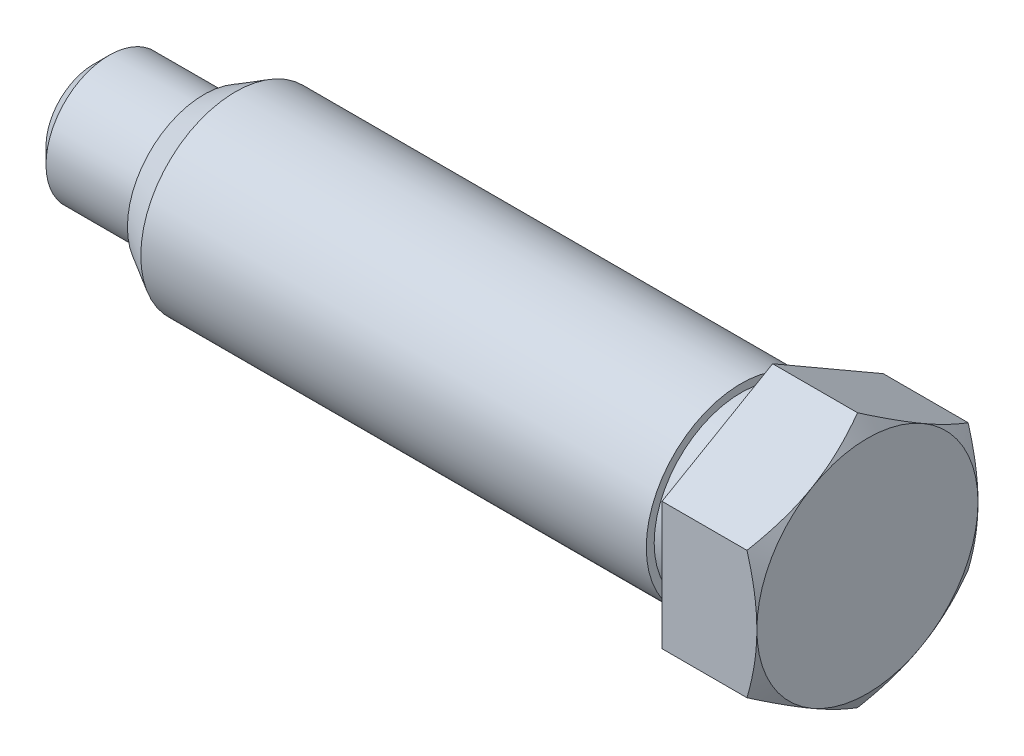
SolidWorks part; units mm, degrees
ref_plane "Plan1" through (0, 0, 0) normal (0, 0, 1) x (1, 0, 0)
ref_plane "Plan2" through (0, 0, 0) normal (0, 1, 0) x (1, 0, 0)
ref_plane "Plan3" through (0, 0, 0) normal (1, 0, 0) x (0, 0, -1)
sketch "Esquisse1" plane through (0, 0, 0) normal (0, 0, 1) x (1, 0, 0)
  line L0 (-100, 0) -> (100, 0) construction
  line L1 (-80, 0) -> (-80, 4)
  line L2 (-80, 4) -> (-73, 4)
  line L3 (-73, 4) -> (-73, 4.8453)
  line L4 (-73, 4.8453) -> (-71, 6)
  line L5 (-71, 6) -> (-39, 6)
  line L6 (-39, 6) -> (-39, 5.5)
  line L7 (-39, 5.5) -> (-37, 5.5)
  line L8 (-37, 5.5) -> (-37, 9)
  line L9 (-37, 9) -> (-32.1547, 9)
  line L10 (-31, 7) -> (-31, 0)
  line L11 (-80, 0) -> (-31, 0)
  line L12 (-31, 7) -> (-32.1547, 9)
  dimension "D1" = 7
  dimension "D2" = 4
  dimension "D3" = 6
  dimension "D4" = 150
  dimension "D5" = 2
  dimension "D6" = 2
  dimension "D7" = 36
  dimension "D8" = 5.5
  dimension "D9" = 7
  dimension "D10" = 9
  dimension "D11" = 30
revolve "Base-Révolution" add sketch "Esquisse1" angle 360 about L0
chamfer "Chanfrein1" distance 1 angle 45
sketch "Esquisse2" plane through (-31, 0, 0) normal (1, 0, 0) x (0, 0, -1)
  line L1 (-7, 10) -> (7, 10)
  line L2 (-7, 10) -> (-7, -10)
  line L3 (-7, -10) -> (7, -10)
  line L4 (7, 10) -> (7, -10)
  dimension "D1" = 7
  dimension "D2" = 7
  dimension "D3" = 10
  dimension "D4" = 10
extrude "Enlèv. mat.-Extru.1" cut sketch "Esquisse2" against normal through all flip side to cut
pattern_circular "Répétition circulaire2" count 3 every 60
